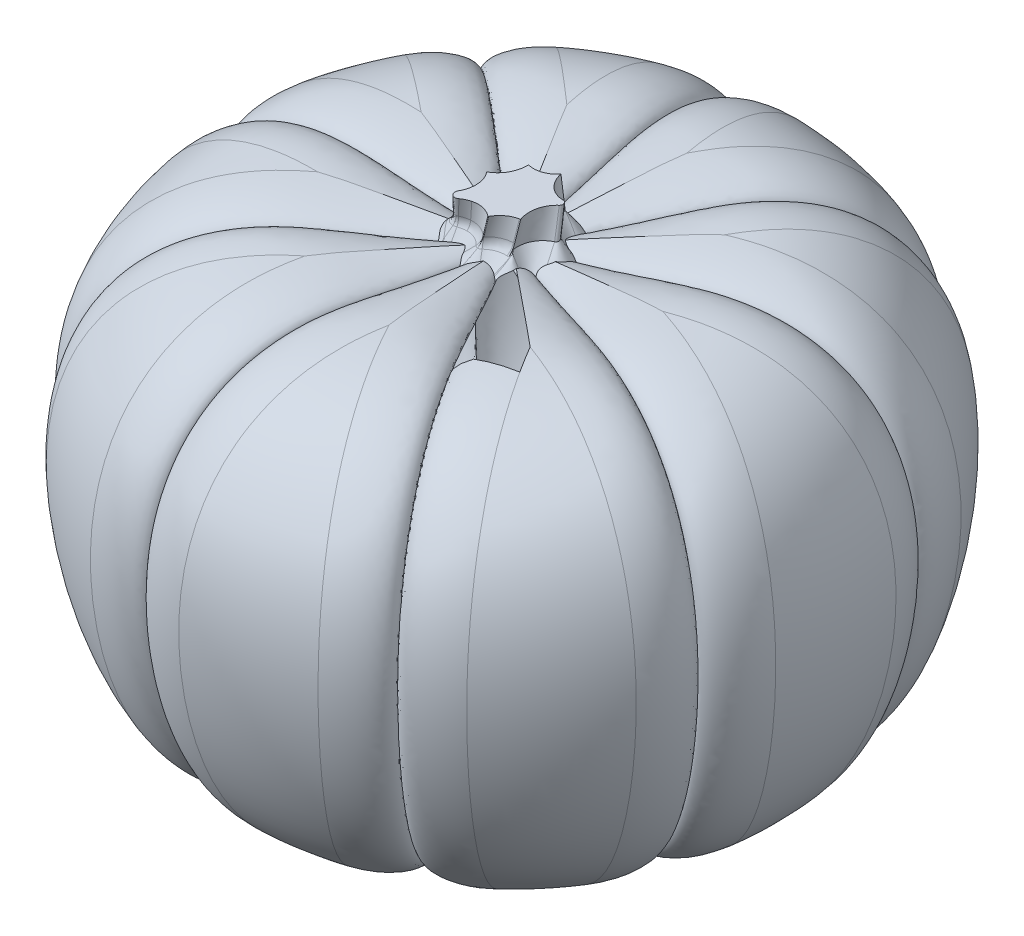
SolidWorks part; units mm, degrees
ref_plane "Front Plane" through (0, 0, 0) normal (0, 0, 1) x (1, 0, 0)
ref_plane "Top Plane" through (0, 0, 0) normal (0, 1, 0) x (1, 0, 0)
ref_plane "Right Plane" through (0, 0, 0) normal (1, 0, 0) x (0, 0, -1)
body saved out of another part "Stock-Pumpkin Mould-1"
